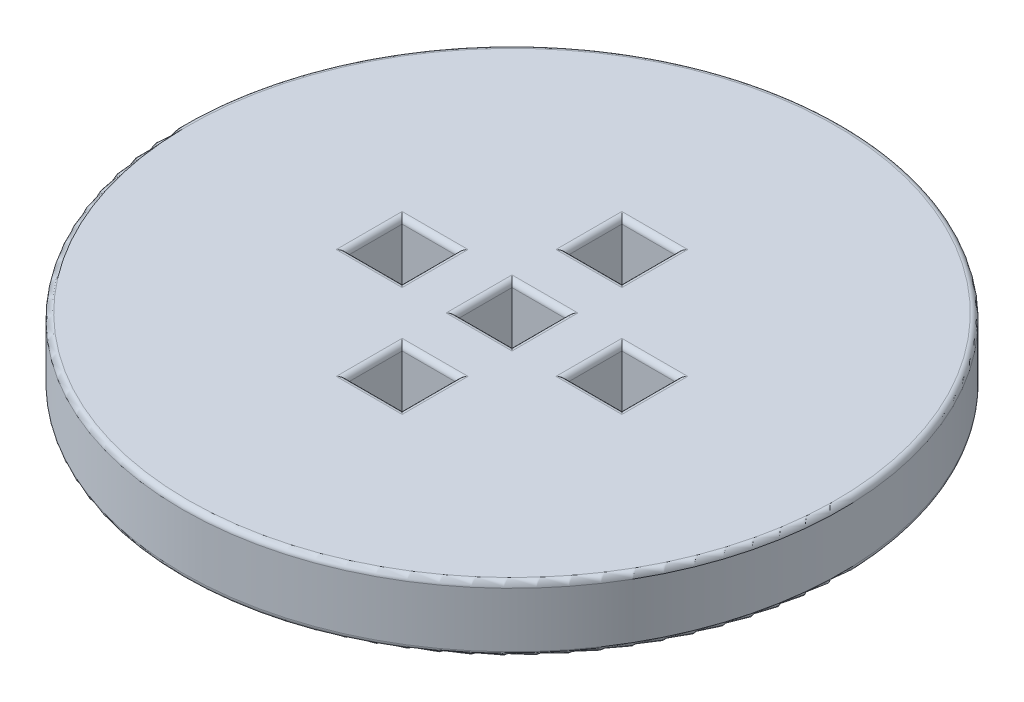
SolidWorks part; units mm, degrees
ref_plane "Front Plane" through (0, 0, 0) normal (0, 0, 1) x (1, 0, 0)
ref_plane "Top Plane" through (0, 0, 0) normal (0, 1, 0) x (1, 0, 0)
ref_plane "Right Plane" through (0, 0, 0) normal (1, 0, 0) x (0, 0, -1)
sketch "Sketch1" plane through (0, 0, 0) normal (0, 1, 0) x (1, 0, 0)
  circle A0 centre (0, 0) radius 30
extrude "Boss-Extrude1" add sketch "Sketch1" along normal blind 6
sketch "Sketch2" plane through (0, 6, 0) normal (0, 1, 0) x (1, 0, 0)
  line L0 (0, 0) -> (0, -10) construction
  line L1 (0, 0) -> (10, 0) construction
  line L2 (0, 0) -> (-10, 0) construction
  line L3 (0, 0) -> (0, 10) construction
  line L5 (-2.5, -7.5) -> (2.5, -7.5)
  line L6 (-2.5, -7.5) -> (-2.5, -12.5)
  line L7 (-2.5, -12.5) -> (2.5, -12.5)
  line L8 (2.5, -7.5) -> (2.5, -12.5)
  line L9 (-2.5, -7.5) -> (2.5, -12.5) construction
  line L10 (-2.5, -12.5) -> (2.5, -7.5) construction
  line L11 (-7.5, -2.5) -> (-12.5, -2.5)
  line L12 (-7.5, -2.5) -> (-7.5, 2.5)
  line L13 (-7.5, 2.5) -> (-12.5, 2.5)
  line L14 (-12.5, -2.5) -> (-12.5, 2.5)
  line L15 (-7.5, -2.5) -> (-12.5, 2.5) construction
  line L16 (-7.5, 2.5) -> (-12.5, -2.5) construction
  line L17 (2.5, -2.5) -> (-2.5, -2.5)
  line L18 (2.5, -2.5) -> (2.5, 2.5)
  line L19 (2.5, 2.5) -> (-2.5, 2.5)
  line L20 (-2.5, -2.5) -> (-2.5, 2.5)
  line L21 (2.5, -2.5) -> (-2.5, 2.5) construction
  line L22 (2.5, 2.5) -> (-2.5, -2.5) construction
  line L23 (-2.5, 12.5) -> (2.5, 12.5)
  line L24 (-2.5, 12.5) -> (-2.5, 7.5)
  line L25 (-2.5, 7.5) -> (2.5, 7.5)
  line L26 (2.5, 12.5) -> (2.5, 7.5)
  line L27 (-2.5, 12.5) -> (2.5, 7.5) construction
  line L28 (-2.5, 7.5) -> (2.5, 12.5) construction
  line L29 (12.5, -2.5) -> (7.5, -2.5)
  line L30 (12.5, -2.5) -> (12.5, 2.5)
  line L31 (12.5, 2.5) -> (7.5, 2.5)
  line L32 (7.5, -2.5) -> (7.5, 2.5)
  line L33 (12.5, -2.5) -> (7.5, 2.5) construction
  line L34 (12.5, 2.5) -> (7.5, -2.5) construction
  dimension "D1" = 5
  dimension "D2" = 10
  dimension "D3" = 5
  dimension "D4" = 5
  dimension "D5" = 5
  dimension "D6" = 5
  dimension "D7" = 5
  dimension "D8" = 5
extrude "Cut-Extrude1" cut sketch "Sketch2" against normal blind 3
fillet "Fillet1" radius 0.5 6 edges at (2.5, 6, 0) (0, 6, 2.5) (-12.5, 6, 0) (-10, 6, 2.5) (-7.5, 6, 0) (-10, 6, -2.5)
sketch "Sketch3" plane through (0, 6, 0) normal (0, 1, 0) x (1, 0, 0)
sketch "Sketch4" plane through (0, 0, 0) normal (0, -1, 0) x (-1, 0, 0)
  line L0 (0, 0) -> (-10, 0) construction
  line L1 (0, 0) -> (0, -10) construction
  line L2 (0, 0) -> (0, 10) construction
  line L3 (0, 0) -> (10, 0) construction
  line L5 (-2.5, 2.5) -> (2.5, 2.5)
  line L6 (-2.5, 2.5) -> (-2.5, -2.5)
  line L7 (-2.5, -2.5) -> (2.5, -2.5)
  line L8 (2.5, 2.5) -> (2.5, -2.5)
  line L9 (-2.5, 2.5) -> (2.5, -2.5) construction
  line L10 (-2.5, -2.5) -> (2.5, 2.5) construction
  line L11 (-2.5, -7.5) -> (2.5, -7.5)
  line L12 (-2.5, -7.5) -> (-2.5, -12.5)
  line L13 (-2.5, -12.5) -> (2.5, -12.5)
  line L14 (2.5, -7.5) -> (2.5, -12.5)
  line L15 (-2.5, -7.5) -> (2.5, -12.5) construction
  line L16 (-2.5, -12.5) -> (2.5, -7.5) construction
  line L17 (7.5, 2.5) -> (12.5, 2.5)
  line L18 (7.5, 2.5) -> (7.5, -2.5)
  line L19 (7.5, -2.5) -> (12.5, -2.5)
  line L20 (12.5, 2.5) -> (12.5, -2.5)
  line L21 (7.5, 2.5) -> (12.5, -2.5) construction
  line L22 (7.5, -2.5) -> (12.5, 2.5) construction
  line L23 (-12.5, 2.5) -> (-7.5, 2.5)
  line L24 (-12.5, 2.5) -> (-12.5, -2.5)
  line L25 (-12.5, -2.5) -> (-7.5, -2.5)
  line L26 (-7.5, 2.5) -> (-7.5, -2.5)
  line L27 (-12.5, 2.5) -> (-7.5, -2.5) construction
  line L28 (-12.5, -2.5) -> (-7.5, 2.5) construction
  line L29 (2.5, 7.5) -> (-2.5, 7.5)
  line L30 (2.5, 7.5) -> (2.5, 12.5)
  line L31 (2.5, 12.5) -> (-2.5, 12.5)
  line L32 (-2.5, 7.5) -> (-2.5, 12.5)
  line L33 (2.5, 7.5) -> (-2.5, 12.5) construction
  line L34 (2.5, 12.5) -> (-2.5, 7.5) construction
  dimension "D1" = 5
  dimension "D2" = 5
  dimension "D3" = 5
  dimension "D4" = 5
  dimension "D5" = 5
  dimension "D6" = 5
extrude "Cut-Extrude2" cut sketch "Sketch4" against normal blind 3
fillet "Fillet2" radius 0.5 21 edges at (0, 0, 30) (2.5, 0, 0) (0, 0, 2.5) (-2.5, 0, 0) (0, 0, -2.5) (2.5, 0, 10) (0, 0, 12.5) (-2.5, 0, 10) (0, 0, 7.5) (-7.5, 0, 0) (-10, 0, 2.5) (-12.5, 0, 0) (-10, 0, -2.5) (12.5, 0, 0) (10, 0, 2.5) (7.5, 0, 0) (10, 0, -2.5) (-2.5, 0, -10) (0, 0, -12.5) (2.5, 0, -10) (0, 0, -7.5)
fillet "Fillet3" radius 0.5 15 edges at (0, 6, 30) (0, 6, 7.5) (-2.5, 6, 10) (0, 6, 12.5) (2.5, 6, 10) (-2.5, 6, 0.25) (0.25, 6, -2.5) (0, 6, -12.5) (-2.5, 6, -10) (0, 6, -7.5) (2.5, 6, -10) (10, 6, 2.5) (12.5, 6, 0) (10, 6, -2.5) (7.5, 6, 0)
sketch "Sketch5" plane through (0, 6, 0) normal (0, 1, 0) x (1, 0, 0)
  text T0 "<b>0</b>"
